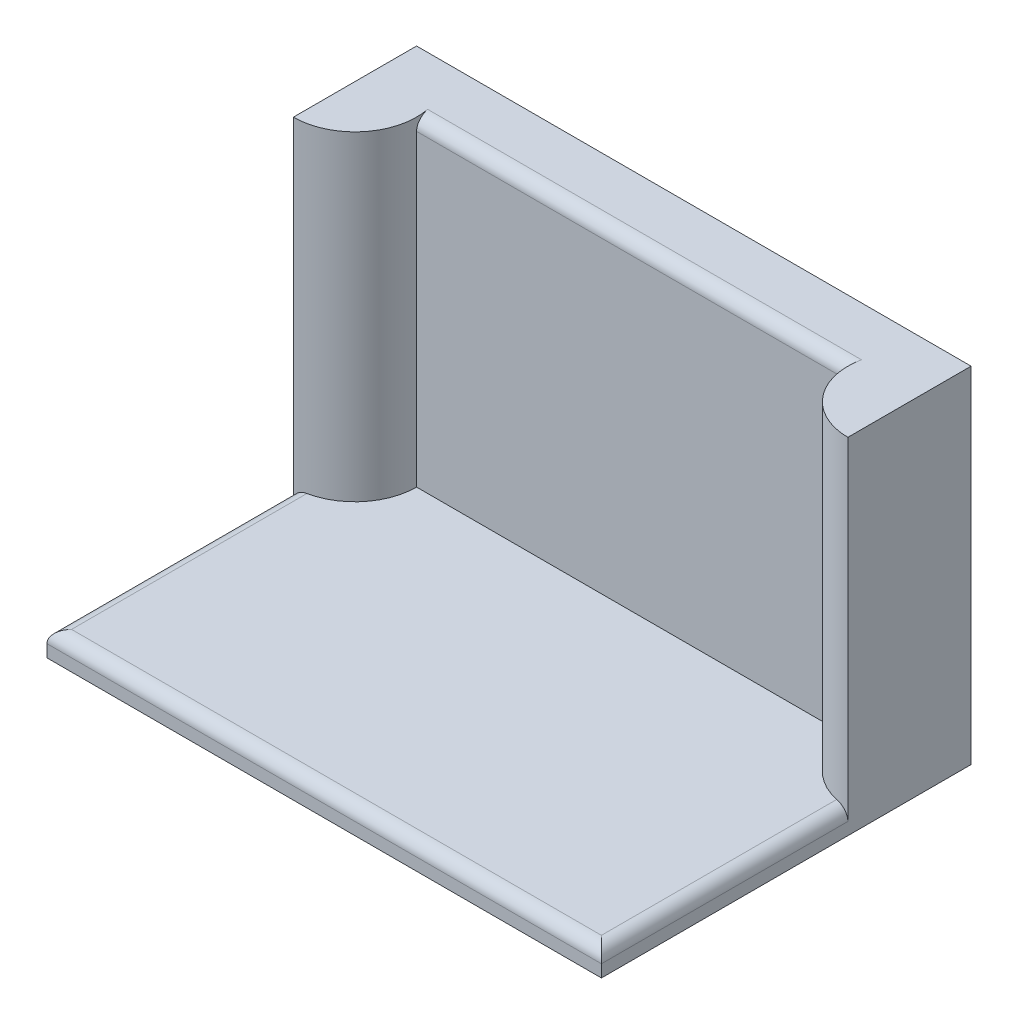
SolidWorks part; units mm, degrees
ref_plane "Front Plane" through (0, 0, 0) normal (0, 0, 1) x (1, 0, 0)
ref_plane "Top Plane" through (0, 0, 0) normal (0, 1, 0) x (1, 0, 0)
ref_plane "Right Plane" through (0, 0, 0) normal (1, 0, 0) x (0, 0, -1)
sketch "Sketch2" plane through (0, 0, 0) normal (1, 0, 0) x (0, 0, -1)
  line L0 (-46.2809, -30.4291) -> (253.7191, -30.4291)
  line L1 (-46.2809, -30.4291) -> (-46.2809, -10.4291)
  line L2 (-46.2809, -10.4291) -> (203.7191, -10.4291)
  line L3 (253.7191, -30.4291) -> (253.7191, 249.5709)
  line L4 (253.7191, 249.5709) -> (203.7191, 249.5709)
  line L5 (203.7191, 249.5709) -> (203.7191, -10.4291)
extrude "Boss-Extrude1" add sketch "Sketch2" along normal blind 450
sketch "Sketch3" plane through (0, 0, -203.7191) normal (0, 0, 1) x (1, 0, 0)
  line L0 (450, -10.4291) -> (0, -10.4291) construction
  line L1 (0, 249.5709) -> (50, 249.5709)
  line L2 (0, 249.5709) -> (0, -10.4291)
  line L3 (0, -10.4291) -> (50, -10.4291)
  line L4 (50, 249.5709) -> (50, -10.4291)
  line L6 (450, 249.5709) -> (400, 249.5709)
  line L7 (450, 249.5709) -> (450, -10.4291)
  line L8 (450, -10.4291) -> (400, -10.4291)
  line L9 (400, 249.5709) -> (400, -10.4291)
  dimension "D1" = 50
  dimension "D2" = 50
extrude "Boss-Extrude2" add sketch "Sketch3" along normal blind 50
fillet "Fillet1" radius 50 5 edges at (50, -10.4291, -178.7191) (50, 249.5709, -178.7191) (25, -10.4291, -153.7191) (50, 119.5709, -153.7191) (25, 249.5709, -153.7191)
fillet "Fillet2" radius 50 5 edges at (400, 249.5709, -178.7191) (400, -10.4291, -178.7191) (425, 249.5709, -153.7191) (400, 119.5709, -153.7191) (425, -10.4291, -153.7191)
fillet "Fillet4" radius 10 1 edges at (225, 249.5709, -203.7191)
fillet "Fillet5" radius 10 3 edges at (225, -10.4291, 46.2809) (0, -10.4291, -53.7191) (450, -10.4291, -53.7191)
